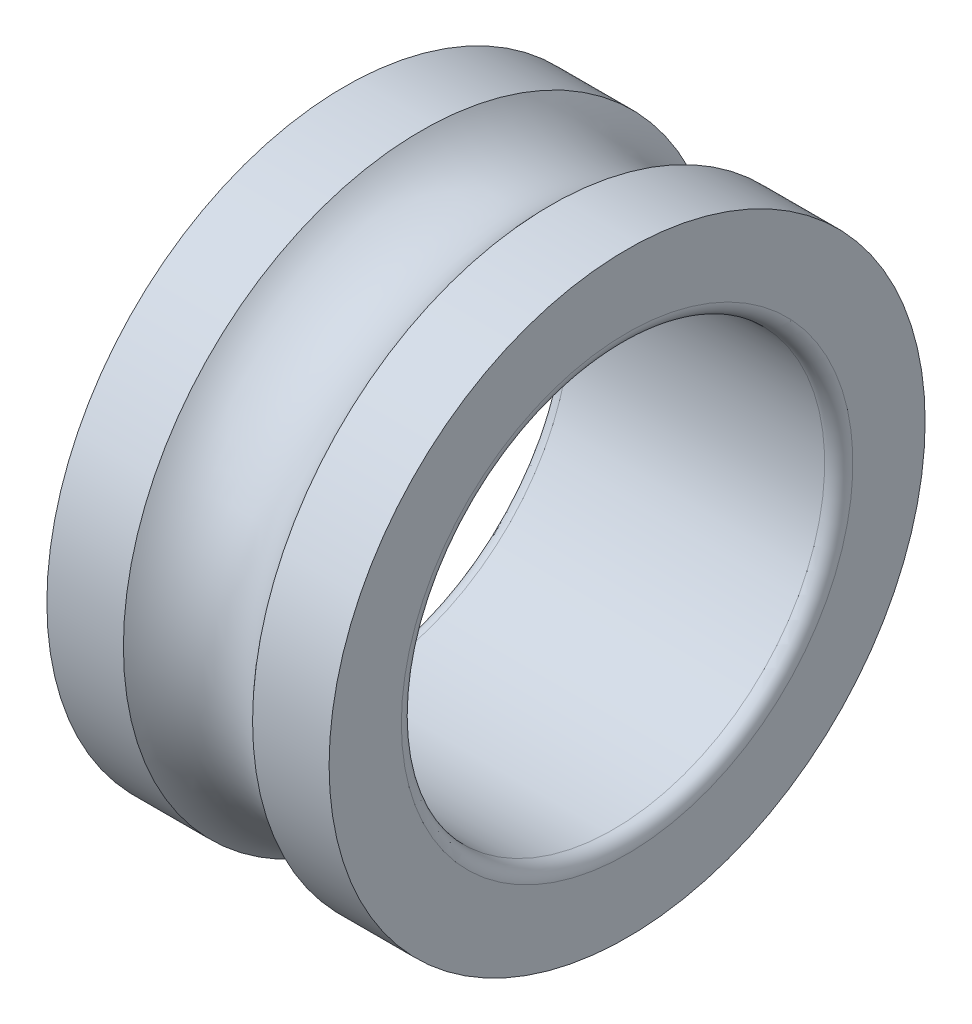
SolidWorks part; units mm, degrees
ref_plane "Plan de face" through (0, 0, 0) normal (0, 0, 1) x (1, 0, 0)
ref_plane "Plan de dessus" through (0, 0, 0) normal (0, 1, 0) x (1, 0, 0)
ref_plane "Plan de droite" through (0, 0, 0) normal (1, 0, 0) x (0, 0, -1)
sketch "Esquisse1" plane through (0, 0, 0) normal (0, 0, 1) x (1, 0, 0)
  line L0 (0, 8.448) -> (0, 6.4)
  line L1 (0.4, 6) -> (7.6, 6)
  line L2 (8, 6.4) -> (8, 8.448)
  line L3 (8, 8.448) -> (5.8307, 8.448)
  line L4 (2.1693, 8.448) -> (0, 8.448)
  line L5 (8, 0) -> (0, 0) construction
  arc A0 (0, 6.4) -> (0.4, 6) centre (0.4, 6.4) ccw
  arc A1 (7.6, 6) -> (8, 6.4) centre (7.6, 6.4) ccw
  arc A2 (5.8307, 8.448) -> (2.1693, 8.448) centre (4, 10) cw
revolve "Révolution1" add sketch "Esquisse1" angle 360 about L5
